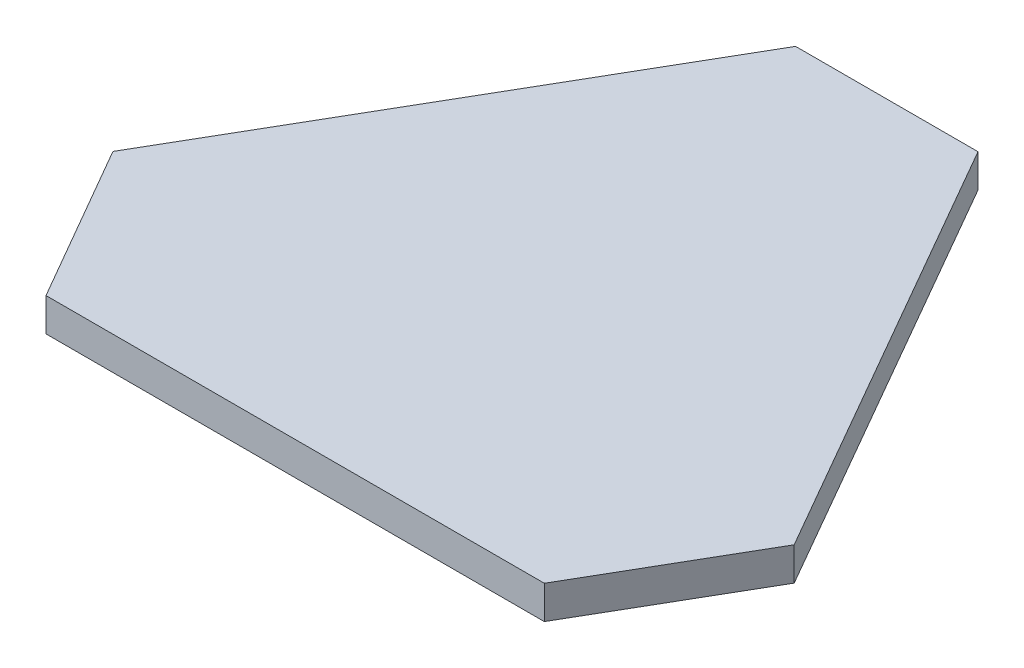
SolidWorks part; units mm, degrees
ref_plane "Ebene vorne" through (0, 0, 0) normal (0, 0, 1) x (1, 0, 0)
ref_plane "Ebene oben" through (0, 0, 0) normal (0, 1, 0) x (1, 0, 0)
ref_plane "Ebene rechts" through (0, 0, 0) normal (1, 0, 0) x (0, 0, -1)
sketch "Skizze1" plane through (0, 0, 0) normal (0, 1, 0) x (1, 0, 0)
  line L0 (-149.9886, 0) -> (150.0755, 0)
  line L1 (-54.2372, 355.613) -> (-204.9943, 95.3014)
  line L4 (205.2183, 95.3014) -> (55.5843, 355.613)
  line L5 (-54.2372, 355.613) -> (55.5843, 355.613)
  line L6 (205.2183, 95.3014) -> (150.0755, 0)
  line L7 (-149.9886, 0) -> (-204.9943, 95.3014)
extrude "Aufsatz-Linear austragen1" add sketch "Skizze1" along normal blind 20 contours L1 L7 L0 L6 L4 L5
